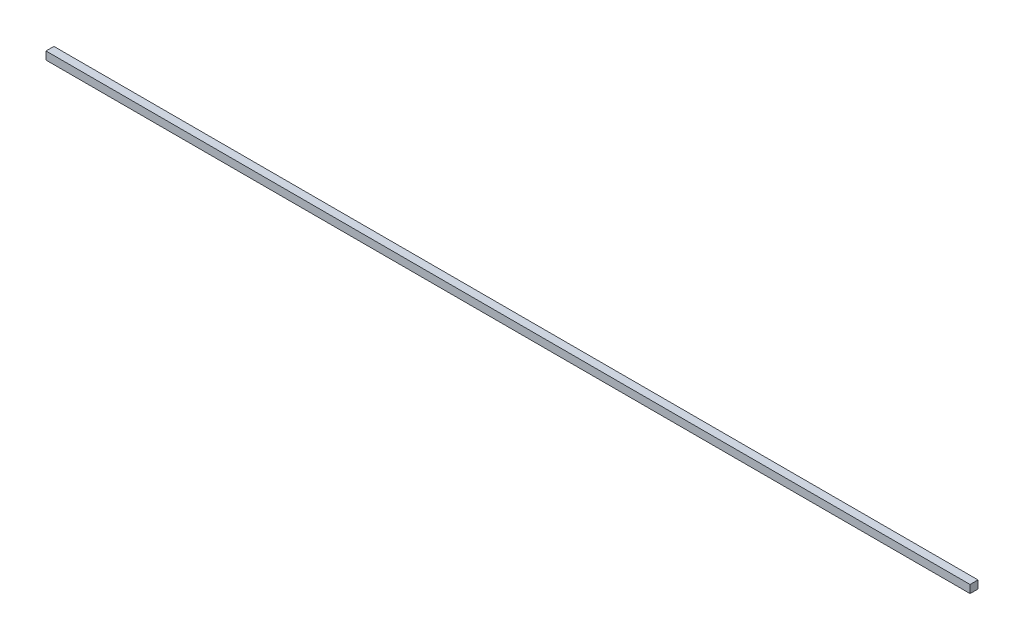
SolidWorks part; units mm, degrees
ref_plane "Face" through (0, 0, 0) normal (0, 0, 1) x (1, 0, 0)
ref_plane "Dessus" through (0, 0, 0) normal (0, 1, 0) x (1, 0, 0)
ref_plane "Droite" through (0, 0, 0) normal (1, 0, 0) x (0, 0, -1)
sketch "Esquisse1" plane through (0, 0, 0) normal (0, 0, 1) x (1, 0, 0)
  line L1 (0, 0) -> (350, 0)
  line L2 (0, 0) -> (0, 3)
  line L3 (0, 3) -> (350, 3)
  line L4 (350, 0) -> (350, 3)
  dimension "D1" = 350
  dimension "D2" = 3
extrude "Extrusion1" add sketch "Esquisse1" along normal blind 3
